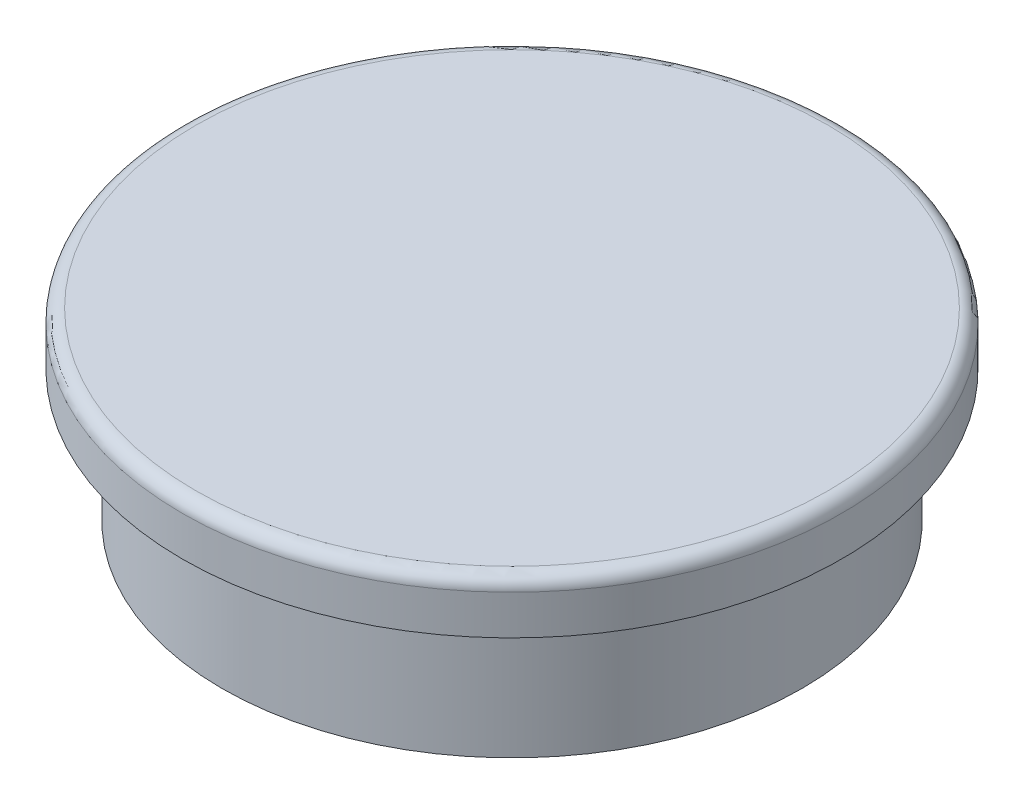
SolidWorks part; units mm, degrees
ref_plane "Ebene vorne" through (0, 0, 0) normal (0, 0, 1) x (1, 0, 0)
ref_plane "Ebene oben" through (0, 0, 0) normal (0, 1, 0) x (1, 0, 0)
ref_plane "Ebene rechts" through (0, 0, 0) normal (1, 0, 0) x (0, 0, -1)
sketch "Skizze1" plane through (0, 0, 0) normal (0, 1, 0) x (1, 0, 0)
  circle A0 centre (0, 0) radius 11
  dimension "D1" = 22
extrude "Aufsatz-Linear austragen1" add sketch "Skizze1" along normal blind 5
sketch "Skizze2" plane through (0, 5, 0) normal (0, 1, 0) x (1, 0, 0)
  circle A0 centre (0, 0) radius 12.5
  dimension "D1" = 25
extrude "Aufsatz-Linear austragen2" add sketch "Skizze2" along normal blind 2
fillet "Verrundung1" radius 0.5 1 edges at (0, 7, 12.5)
